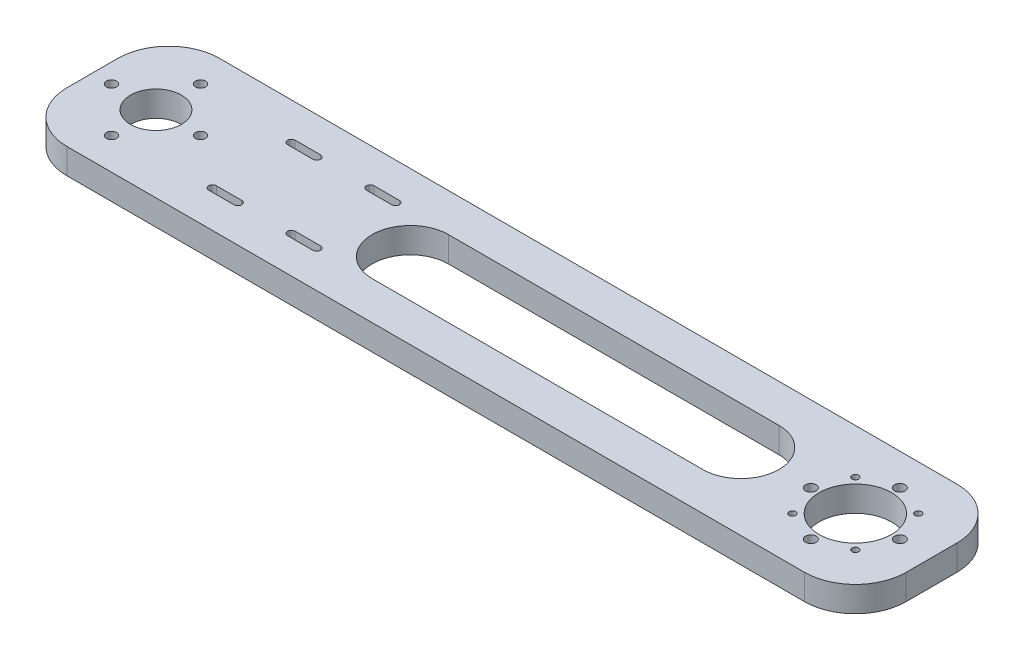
SolidWorks part; units mm, degrees
ref_plane "前视基准面" through (0, 0, 0) normal (0, 0, 1) x (1, 0, 0)
ref_plane "上视基准面" through (0, 0, 0) normal (0, 1, 0) x (1, 0, 0)
ref_plane "右视基准面" through (0, 0, 0) normal (1, 0, 0) x (0, 0, -1)
other "Configuration Table"
sketch "草图1" plane through (0, 0, 0) normal (0, 1, 0) x (1, 0, 0)
  line L1 (-165, -30) -> (165, -30)
  line L2 (-165, -30) -> (-165, 30)
  line L3 (-165, 30) -> (165, 30)
  line L4 (165, -30) -> (165, 30)
  line L5 (-165, -30) -> (165, 30) construction
  line L6 (-165, 30) -> (165, -30) construction
  point P0 (0, 0)
  dimension "D1" = 330
  dimension "D2" = 60
extrude "凸台-拉伸1" add sketch "草图1" along normal blind 10
fillet "圆角1" radius 20 4 edges at (-165, 5, -30) (-165, 5, 30) (165, 5, -30) (165, 5, 30)
sketch "草图5" plane through (0, 0, 0) normal (0, -1, 0) x (1, 0, 0)
  line L1 (-145, 30) -> (145, 30) construction
  line L2 (-165, -10) -> (-165, 10) construction
  circle A0 centre (-140, 0) radius 10
  dimension "D1" = 20
  dimension "D2" = 30
  dimension "D3" = 25
extrude "切除-拉伸3" cut sketch "草图5" against normal blind 10
sketch "草图15" plane through (0, 0, 0) normal (0, -1, 0) x (1, 0, 0)
  line L0 (165, 10) -> (165, -10) construction
  line L1 (-145, 30) -> (145, 30) construction
  circle A0 centre (135, 0) radius 14.25
  dimension "D1" = 30
  dimension "D2" = 30
  dimension "D3" = 28.5
extrude "切除-拉伸12" cut sketch "草图15" against normal through all
sketch "草图18" plane through (0, 0, 0) normal (0, -1, 0) x (1, 0, 0)
  circle A0 centre (122.6256, 12.3744) radius 1.3
  circle A1 centre (147.3744, 12.3744) radius 1.3
  circle A2 centre (147.3744, -12.3744) radius 1.3
  circle A3 centre (122.6256, -12.3744) radius 1.3
  dimension "D1" = 2.6
  dimension "D2" = 2.6
  dimension "D3" = 2.6
  dimension "D4" = 2.6
extrude "切除-拉伸14" cut sketch "草图18" against normal through all
sketch "草图19" plane through (0, 0, 0) normal (0, -1, 0) x (-1, 0, 0)
  line L0 (102.2654, -15.5) -> (92.2654, -15.5) construction
  line L3 (165, 0) -> (-165, 0) construction
  line L4 (165, 10) -> (165, -10) construction
  line L5 (-165, -10) -> (-165, 10) construction
  line L6 (102.2654, 15.5) -> (92.2654, 15.5) construction
  line L7 (102.2654, 17) -> (92.2654, 17)
  line L8 (102.2654, 14) -> (92.2654, 14)
  line L9 (71.2654, -15.5) -> (61.2654, -15.5) construction
  line L10 (71.2654, -17) -> (61.2654, -17)
  line L11 (71.2654, -14) -> (61.2654, -14)
  line L12 (71.2654, 15.5) -> (61.2654, 15.5) construction
  line L13 (71.2654, 17) -> (61.2654, 17)
  line L14 (71.2654, 14) -> (61.2654, 14)
  line L15 (102.2654, -17) -> (92.2654, -17)
  line L16 (102.2654, -14) -> (92.2654, -14)
  arc A2 (102.2654, 17) -> (102.2654, 14) centre (102.2654, 15.5) cw
  arc A3 (92.2654, 14) -> (92.2654, 17) centre (92.2654, 15.5) cw
  arc A4 (71.2654, -17) -> (71.2654, -14) centre (71.2654, -15.5) ccw
  arc A5 (61.2654, -14) -> (61.2654, -17) centre (61.2654, -15.5) ccw
  arc A6 (71.2654, 17) -> (71.2654, 14) centre (71.2654, 15.5) cw
  arc A7 (61.2654, 14) -> (61.2654, 17) centre (61.2654, 15.5) cw
  arc A8 (102.2654, -17) -> (102.2654, -14) centre (102.2654, -15.5) ccw
  arc A9 (92.2654, -14) -> (92.2654, -17) centre (92.2654, -15.5) ccw
  point P2 (97.2654, -15.5)
  point P17 (97.2654, 15.5)
  point P24 (66.2654, -15.5)
  point P31 (66.2654, 15.5)
  dimension "D4" = 10
  dimension "D3" = 3
extrude "切除-拉伸15" cut sketch "草图19" against normal through all
sketch "草图20" plane through (0, 10, 0) normal (0, 1, 0) x (1, 0, 0)
  line L0 (-140, 10) -> (-140, -10) construction
  line L1 (-150, 0) -> (-130, 0) construction
  circle A4 centre (-140, 0) radius 10 construction
  circle A5 centre (-140, 0) radius 17.5 construction
  circle A6 centre (-140, 17.5) radius 2
  dimension "D1" = 4
extrude "切除-拉伸16" cut sketch "草图20" against normal blind 10
sketch "草图21" plane through (0, 0, 0) normal (0, -1, 0) x (1, 0, 0)
  circle A0 centre (135, 0) radius 17.5
  circle A1 centre (135, 17.5) radius 2.1
  circle A2 centre (152.5, 0) radius 2.1
  circle A3 centre (135, -17.5) radius 2.1
  circle A4 centre (117.5, 0) radius 2.1
  dimension "D1" = 35
  dimension "D2" = 4.2
  dimension "D3" = 4.2
  dimension "D4" = 4.2
  dimension "D5" = 4.2
extrude "切除-拉伸17" cut sketch "草图21" against normal blind 10 contours A0 A1 | A0 A1 | A0 A2 | A0 A2 | A0 A3 | A0 A4 | A0 A4
sketch "草图22" plane through (0, 10, 0) normal (0, 1, 0) x (1, 0, 0)
  line L0 (-40, 0) -> (90, 0) construction
  line L1 (-40, 15) -> (90, 15)
  line L2 (-40, -15) -> (90, -15)
  line L3 (145, 30) -> (-145, 30) construction
  line L4 (165, -10) -> (165, 10) construction
  arc A0 (-40, 15) -> (-40, -15) centre (-40, 0) ccw
  arc A1 (90, -15) -> (90, 15) centre (90, 0) ccw
  point P2 (25, 0)
  dimension "D3" = 140
  dimension "D1" = 130
  dimension "D2" = 15
extrude "切除-拉伸18" cut sketch "草图22" against normal through all
pattern_circular "阵列(圆周)1" count 4 every 90 about axis through (-140, 0, 0) along (0, 1, 0) of "切除-拉伸16"
